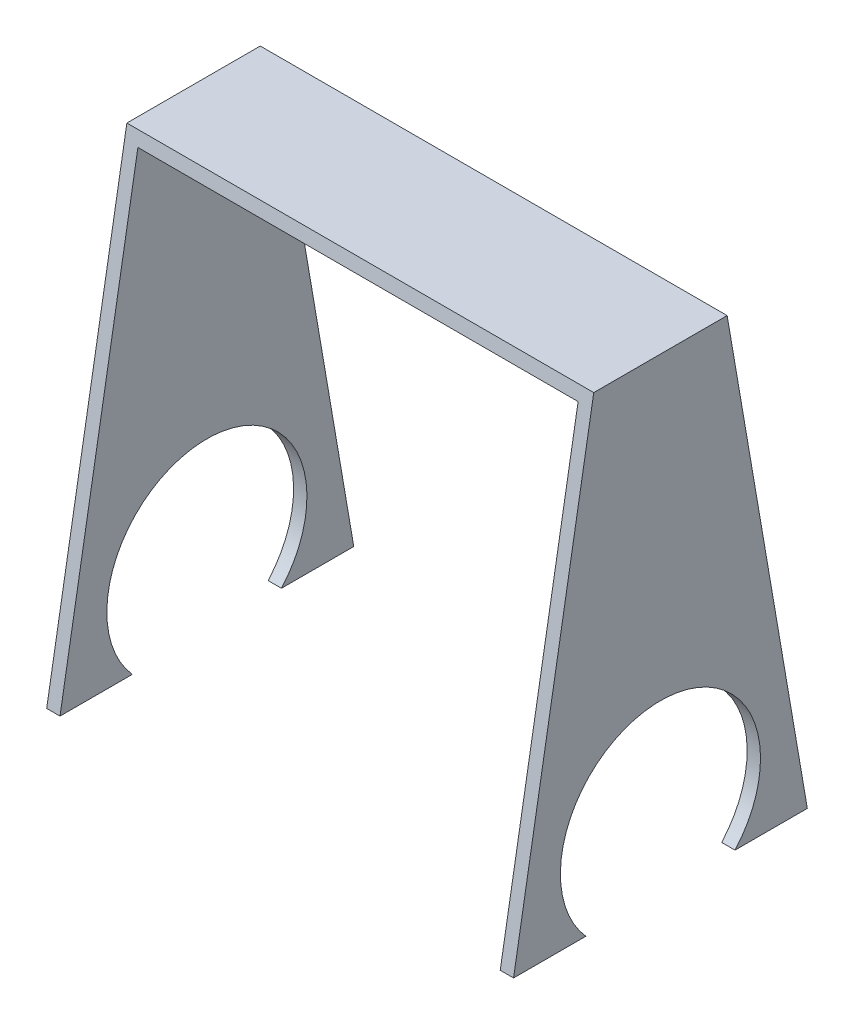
SolidWorks part; units mm, degrees
ref_plane "Plan1" through (0, 0, 0) normal (0, 0, 1) x (1, 0, 0)
ref_plane "Plan2" through (0, 0, 0) normal (0, 1, 0) x (1, 0, 0)
ref_plane "Plan3" through (0, 0, 0) normal (1, 0, 0) x (0, 0, -1)
sketch "Esquisse1" plane through (0, 0, 0) normal (0, 0, 1) x (1, 0, 0)
  line L0 (-30, 50) -> (-30, 43)
  line L1 (-30, 50) -> (-23, 50)
  line L2 (-23, 50) -> (-23, 43)
  line L3 (-23, 43) -> (-23.2, 43)
  line L4 (-23.2, 43) -> (-23.2, 49.8)
  line L5 (-23.2, 49.8) -> (-29.8, 49.8)
  line L6 (-29.8, 49.8) -> (-29.8, 43)
  line L7 (-29.8, 43) -> (-30, 43)
  dimension "D1" = 0.2
  dimension "D2" = 0.2
  dimension "D3" = 0.2
  dimension "D4" = 7
  dimension "D5" = 7
  dimension "D6" = 7
extrude "Base-Extrusion" add sketch "Esquisse1" along normal blind 4.5
sketch "Esquisse2" plane through (-23, 0, 0) normal (1, 0, 0) x (0, 0, -1)
  line L1 (-4.5, 43) -> (0, 43) construction
  circle A0 centre (-2.25, 44) radius 1.5
  dimension "D1" = 3
  dimension "D2" = 1
extrude "Enlèv. mat.-Extru.2" cut sketch "Esquisse2" against normal through all
sketch "Esquisse3" plane through (-23, 0, 0) normal (1, 0, 0) x (0, 0, -1)
  line L0 (-3.25, 50) -> (-1.25, 50)
  line L3 (-4.5, 50) -> (0, 50) construction
  line L4 (-3.25, 50) -> (-4.5, 42.7212)
  line L5 (-4.5, 43) -> (-4.5, 50) construction
  line L6 (-4.5, 42.7212) -> (0, 42.7212)
  line L7 (0, 42.7212) -> (-1.25, 50)
  line L9 (-10, 60) -> (10, 60)
  line L10 (-10, 60) -> (-10, 40)
  line L11 (-10, 40) -> (10, 40)
  line L12 (10, 60) -> (10, 40)
  dimension "D1" = 1.25
  dimension "D2" = 2
extrude "Enlèv. mat.-Extru.3" cut sketch "Esquisse3" against normal through all
